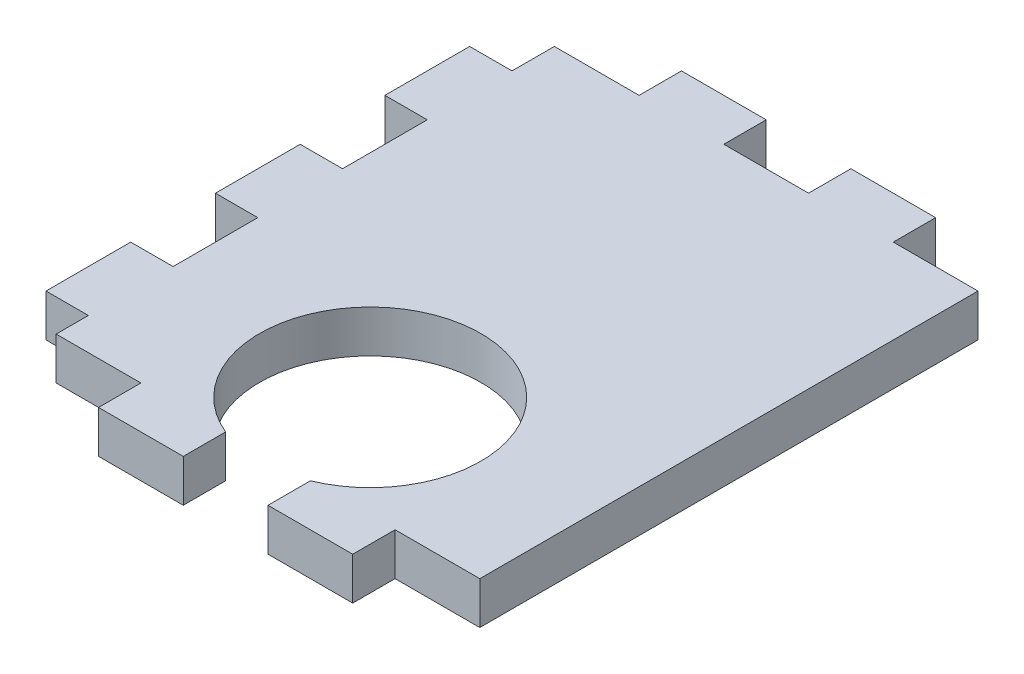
SolidWorks part; units mm, degrees
ref_plane "Front Plane" through (0, 0, 0) normal (0, 0, 1) x (1, 0, 0)
ref_plane "Top Plane" through (0, 0, 0) normal (0, 1, 0) x (1, 0, 0)
ref_plane "Right Plane" through (0, 0, 0) normal (1, 0, 0) x (0, 0, -1)
sketch "Sketch1" plane through (0, 0, 0) normal (0, 1, 0) x (1, 0, 0)
  line L1 (0, 0) -> (34.925, 0)
  line L2 (0, 0) -> (0, 43.688)
  line L3 (0, 43.688) -> (34.925, 43.688)
  line L4 (34.925, 0) -> (34.925, 43.688)
  dimension "D1" = 43.688
  dimension "D2" = 34.925
extrude "body" add sketch "Sketch1" along normal blind 3.175
sketch "Sketch4" plane through (0, 3.175, 0) normal (0, 1, 0) x (1, 0, 0)
  line L0 (0, 21.844) -> (34.925, 21.844) construction
  line L1 (34.925, 43.688) -> (0, 43.688) construction
  line L2 (0, 43.688) -> (0, 0) construction
  line L3 (3.175, 43.688) -> (9.525, 43.688)
  line L4 (3.175, 43.688) -> (3.175, 40.513)
  line L6 (34.925, 0) -> (34.925, 43.688) construction
  line L7 (3.175, 40.513) -> (9.525, 40.513)
  line L8 (9.525, 43.688) -> (9.525, 40.513)
  line L9 (9.525, 0) -> (9.525, 3.175)
  line L10 (3.175, 3.175) -> (9.525, 3.175)
  line L11 (3.175, 0) -> (3.175, 3.175)
  line L12 (3.175, 0) -> (9.525, 0)
  dimension "D1" = 3.175
  dimension "D2" = 6.35
  dimension "D3" = 3.175
extrude "teeth" cut sketch "Sketch4" against normal up to surface (3.175 mm away)
pattern_linear "teeth pattern" count 28 spacing 12.7 along (1, 0, 0) of "teeth"
sketch "Sketch7" plane through (0, 3.175, 0) normal (0, 1, 0) x (1, 0, 0)
  line L0 (3.175, 40.513) -> (9.525, 40.513) construction
  line L1 (4.0757, 40.513) -> (2.1214, 40.513)
  line L2 (4.0757, 40.513) -> (4.0757, 3.175)
  line L3 (4.0757, 3.175) -> (2.1214, 3.175)
  line L4 (2.1214, 40.513) -> (2.1214, 3.175)
  line L5 (9.525, 3.175) -> (3.175, 3.175) construction
extrude "Boss-Extrude3" add sketch "Sketch7" against normal up to surface (3.175 mm away)
sketch "Sketch5" plane through (0, 3.175, 0) normal (0, 1, 0) x (1, 0, 0)
  line L0 (0, 43.688) -> (3.175, 43.688)
  line L1 (3.175, 43.688) -> (0, 43.688) construction
  line L2 (3.175, 43.688) -> (3.175, 0)
  line L3 (3.175, 0) -> (0, 0)
  line L8 (0, 0) -> (0, 43.688)
  line L9 (0, 37.338) -> (3.175, 37.338)
  line L10 (0, 30.988) -> (3.175, 30.988)
  line L11 (0, 24.638) -> (3.175, 24.638)
  line L12 (0, 18.288) -> (3.175, 18.288)
  line L13 (0, 11.938) -> (3.175, 11.938)
  line L14 (0, 5.588) -> (3.175, 5.588)
  dimension "D1" = 3.175
  dimension "D2" = 7
extrude "Cut-Extrude2" cut sketch "Sketch5" against normal up to surface (3.175 mm away) contours L8 L9 L2 L0 | L8 L11 L2 L10 | L8 L13 L2 L12 | L14 L8 L3 L2
sketch "Sketch8" plane through (0, 3.175, 0) normal (0, 1, 0) x (1, 0, 0)
  arc A0 (15.875, 3.175) -> (22.225, 3.175) centre (19.05, 10.8367) cw
extrude "Cut-Extrude5" cut sketch "Sketch8" against normal through all and the other way through all contours A0 M14
